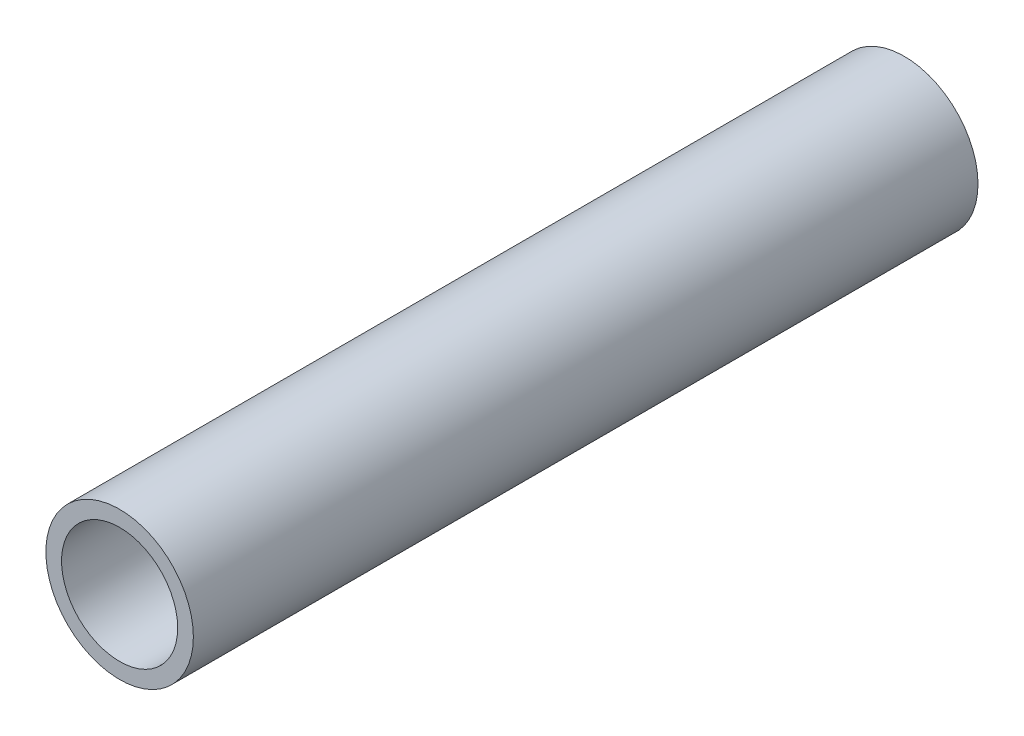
SolidWorks part; units mm, degrees
ref_plane "Front" through (0, 0, 0) normal (0, 0, 1) x (1, 0, 0)
ref_plane "Top" through (0, 0, 0) normal (0, 1, 0) x (1, 0, 0)
ref_plane "Side" through (0, 0, 0) normal (1, 0, 0) x (0, 0, -1)
sketch "PipeSketch" plane through (0, 0, 0) normal (0, 0, 1) x (1, 0, 0)
  circle A0 centre (0, 0) radius 1.1938
  circle A1 centre (0, 0) radius 0.9398 construction
  dimension "OuterDiameter" = 2.3876
  dimension "InnerDiameter" = 1.8796
sketch "FilterSketch" plane through (0, 0, 0) normal (0, 0, 1) x (1, 0, 0)
  circle A0 centre (0, 0) radius 1.1938 construction
  dimension "NominalDiameter" = 2.3876
sketch3d "3DSketch1"
  line L0 (0, 0, 0) -> (0, 0, 12.7)
sweep "ThinSweep" add profiles "PipeSketch" path "3DSketch1" parameters "WallThickness"=0.254
